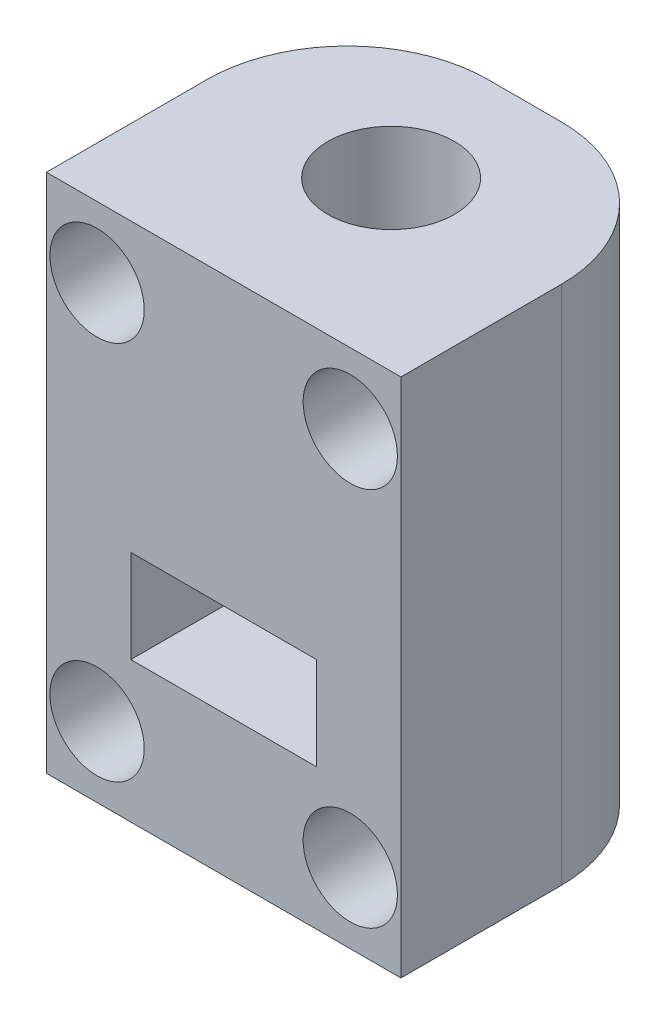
SolidWorks part; units mm, degrees
ref_plane "Plan de face" through (0, 0, 0) normal (0, 0, 1) x (1, 0, 0)
ref_plane "Plan de dessus" through (0, 0, 0) normal (0, 1, 0) x (1, 0, 0)
ref_plane "Plan de droite" through (0, 0, 0) normal (1, 0, 0) x (0, 0, -1)
sketch "Esquisse1" plane through (0, 0, 0) normal (0, 0, 1) x (1, 0, 0)
  line L1 (0, 0) -> (25.2, 0)
  line L2 (0, 0) -> (0, 37)
  line L3 (0, 37) -> (25.2, 37)
  line L4 (25.2, 0) -> (25.2, 37)
  dimension "D1" = 37
  dimension "D2" = 25.2
extrude "Boss.-Extru.1" add sketch "Esquisse1" along normal blind 21.4
sketch "Esquisse2" plane through (0, 0, 0) normal (0, -1, 0) x (-1, 0, 0)
  line L0 (0, -21.4) -> (0, 0) construction
  line L1 (0, 0) -> (-25.2, 0) construction
  circle A0 centre (-12.6, -9.5) radius 4.5
  dimension "D1" = 12.6
  dimension "D2" = 9.5
extrude "Enlèv. mat.-Extru.1" cut sketch "Esquisse2" against normal blind 18 from offset 10
sketch "Esquisse3" plane through (0, 0, 0) normal (0, -1, 0) x (-1, 0, 0)
  line L0 (0, -21.4) -> (0, 0) construction
  line L1 (-6.6, -25.5355) -> (-18.6, -25.5355)
  line L2 (-6.6, -25.5355) -> (-6.6, -9.7973)
  line L3 (-6.6, -9.7973) -> (-18.6, -9.7973)
  line L4 (-18.6, -25.5355) -> (-18.6, -9.7973)
  line L5 (-25.2, -21.4) -> (-25.2, 0) construction
  dimension "D1" = 6.6
  dimension "D2" = 6.6
sketch "Esquisse4" plane through (0, 0, 0) normal (0, -1, 0) x (1, 0, 0)
  line L0 (6, 13.3105) -> (6, 23.2181)
  line L1 (6, 23.2181) -> (19.2, 23.2181)
  line L2 (6, 13.3105) -> (6, 5.6895)
  line L3 (6, 5.6895) -> (12.6, 1.879)
  line L4 (12.6, 1.879) -> (19.2, 5.6895)
  line L5 (19.2, 5.6895) -> (19.2, 13.3105)
  line L6 (19.2, 23.2181) -> (19.2, 13.3105)
  line L7 (12.6, 17.121) -> (6, 13.3105)
  line L8 (19.2, 13.3105) -> (12.6, 17.121)
  circle A0 centre (12.6, 9.5) radius 6.6 construction
extrude "Enlèv. mat.-Extru.3" cut sketch "Esquisse4" against normal blind 6.6 from offset 10
sketch "Esquisse6" plane through (0, 0, 0) normal (0, -1, 0) x (-1, 0, 0)
  circle A0 centre (-12.6, -9.5) radius 4.5
  circle A1 centre (-12.6, -9.5) radius 4.5 construction
extrude "Enlèv. mat.-Extru.4" cut sketch "Esquisse6" against normal through all contours A0
sketch "Esquisse5" plane through (0, 0, 21.4) normal (0, 0, 1) x (1, 0, 0)
  line L0 (25.2, 37) -> (0, 37) construction
  line L1 (0, 37) -> (0, 0) construction
  line L2 (25.2, 0) -> (25.2, 37) construction
  line L3 (0, 0) -> (25.2, 0) construction
  circle A0 centre (3.6, 32) radius 3.35
  circle A1 centre (21.6, 32) radius 3.35
  circle A2 centre (3.6, 5) radius 3.35
  circle A3 centre (21.6, 5) radius 3.35
  dimension "D1" = 5
  dimension "D2" = 3.6
  dimension "D4" = 5
  dimension "D5" = 5
  dimension "D3" = 3.6
  dimension "D6" = 3.6
  dimension "D7" = 3.6
  dimension "D8" = 18
  dimension "D9" = 27
  dimension "D10" = 5
fillet "Congé1" radius 10 2 edges at (0, 18.5, 0) (25.2, 18.5, 0)
extrude "Enlèv. mat.-Extru.5" cut sketch "Esquisse5" against normal blind 10 contours A0
